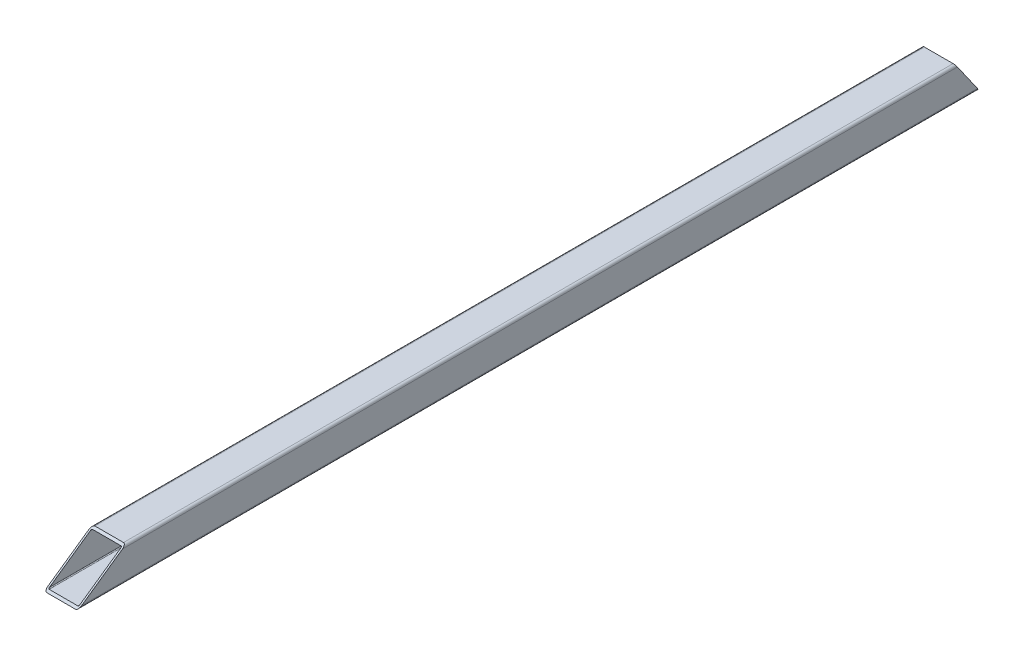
SolidWorks part; units mm, degrees
ref_plane "Face" through (0, 0, 0) normal (0, 0, 1) x (1, 0, 0)
ref_plane "Dessus" through (0, 0, 0) normal (0, 1, 0) x (1, 0, 0)
ref_plane "Droite" through (0, 0, 0) normal (1, 0, 0) x (0, 0, -1)
sketch "Esquisse1" plane through (0, 0, 0) normal (0, 0, 1) x (1, 0, 0)
  line L0 (2, -3) -> (2, -37)
  line L1 (3, 0) -> (37, 0)
  line L2 (0, -3) -> (0, -37)
  line L3 (3, -40) -> (37, -40)
  line L4 (40, -3) -> (40, -37)
  line L5 (3, -38) -> (37, -38)
  line L6 (38, -3) -> (38, -37)
  line L7 (3, -2) -> (37, -2)
  arc A0 (0, -3) -> (3, 0) centre (3, -3) cw
  arc A1 (0, -37) -> (3, -40) centre (3, -37) ccw
  arc A2 (37, 0) -> (40, -3) centre (37, -3) cw
  arc A3 (37, -40) -> (40, -37) centre (37, -37) ccw
  arc A4 (2, -37) -> (3, -38) centre (3, -37) ccw
  arc A5 (37, -38) -> (38, -37) centre (37, -37) ccw
  arc A6 (37, -2) -> (38, -3) centre (37, -3) cw
  arc A7 (2, -3) -> (3, -2) centre (3, -3) cw
  point P7 (0, 0)
  point P10 (0, -40)
  point P13 (40, 0)
  dimension "D3" = 3
  dimension "D1" = 40
  dimension "D2" = 40
  dimension "D4" = 2
extrude "Base-Extrusion" add sketch "Esquisse1" along normal blind 1070
sketch "Esquisse2" plane through (0, 0, 0) normal (-1, 0, 0) x (0, 0, 1)
  line L0 (0, 0) -> (0, -40)
  line L1 (0, -40) -> (28.0083, 0)
  line L2 (28.0083, 0) -> (0, 0)
  line L3 (0, -3) -> (0, -37) construction
  line L4 (1070, 0) -> (0, 0) construction
  line L5 (1070, -40) -> (0, -40) construction
  dimension "D1" = 55
extrude "Enlèv. mat.-Extru.1" cut sketch "Esquisse2" against normal through all
sketch "Esquisse3" plane through (0, 0, 0) normal (-1, 0, 0) x (0, 0, 1)
  line L0 (1012.8741, 0) -> (1070, -40)
  line L1 (1070, -40) -> (1070, 0)
  line L2 (1070, 0) -> (1012.8741, 0)
  line L3 (1070, -3) -> (1070, -37) construction
  line L4 (1070, 0) -> (28.0083, 0) construction
  line L5 (1070, -40) -> (0, -40) construction
  dimension "D1" = 35
extrude "Enlèv. mat.-Extru.2" cut sketch "Esquisse3" against normal through all
